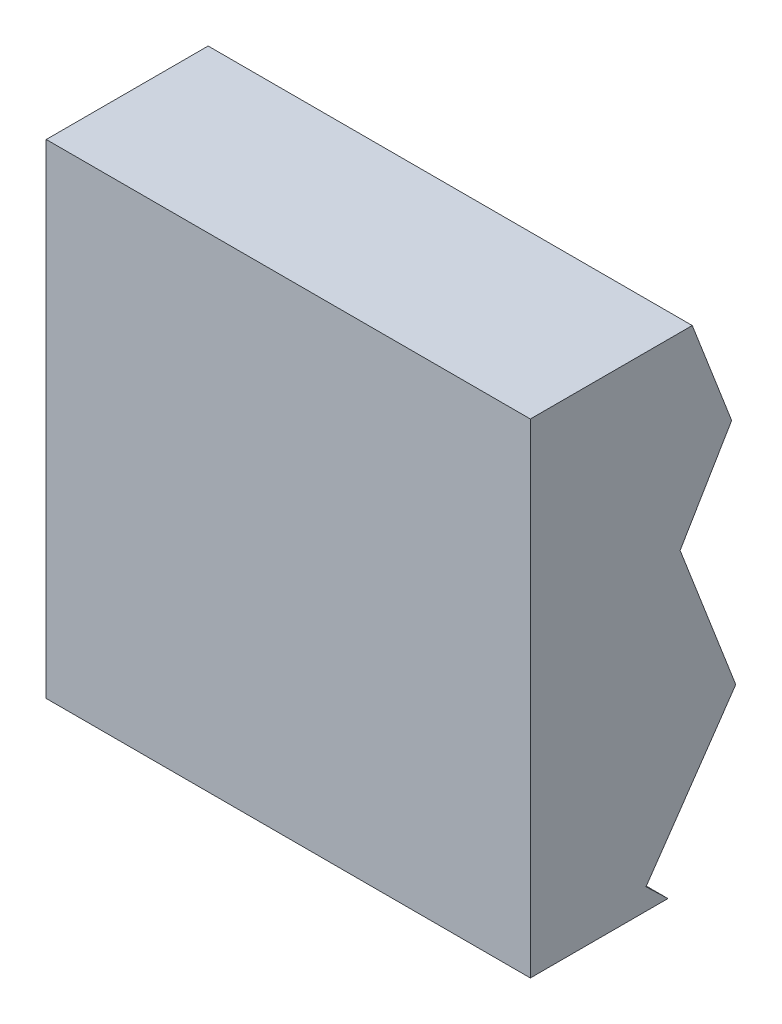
SolidWorks part; units mm, degrees
ref_plane "Ebene vorne" through (0, 0, 0) normal (0, 0, 1) x (1, 0, 0)
ref_plane "Ebene oben" through (0, 0, 0) normal (0, 1, 0) x (1, 0, 0)
ref_plane "Ebene rechts" through (0, 0, 0) normal (1, 0, 0) x (0, 0, -1)
sketch "Skizze1" plane through (0, 0, 0) normal (0, 0, 1) x (1, 0, 0)
  line L1 (-50, -50) -> (50, -50)
  line L2 (-50, -50) -> (-50, 50)
  line L3 (-50, 50) -> (50, 50)
  line L4 (50, -50) -> (50, 50)
  line L5 (-50, -50) -> (50, 50) construction
  line L6 (-50, 50) -> (50, -50) construction
  point P0 (0, 0)
  dimension "D1" = 100
  dimension "D2" = 100
extrude "Aufsatz-Linear austragen1" add sketch "Skizze1" along normal blind 100
shell "Wandung1" thickness 1
sketch "Skizze2" plane through (50, 0, 0) normal (1, 0, 0) x (0, 0, -1)
  line L0 (-66.5591, 50) -> (-58.421, 28.9465)
  line L1 (-100, 50) -> (0, 50) construction
  line L2 (-58.421, 28.9465) -> (-69.0666, 11.0147)
  line L3 (-69.0666, 11.0147) -> (-57.5721, -18.7217)
  line L4 (-57.5721, -18.7217) -> (-76.1096, -45.6243)
  line L5 (-76.1096, -45.6243) -> (-71.5746, -50)
  line L6 (-100, -50) -> (0, -50) construction
  line L8 (-66.5591, 50) -> (0, 50)
  line L9 (0, 50) -> (0, -50)
  line L11 (0, -50) -> (-71.5746, -50)
extrude "Schnitt-Linear austragen1" cut sketch "Skizze2" against normal through all
